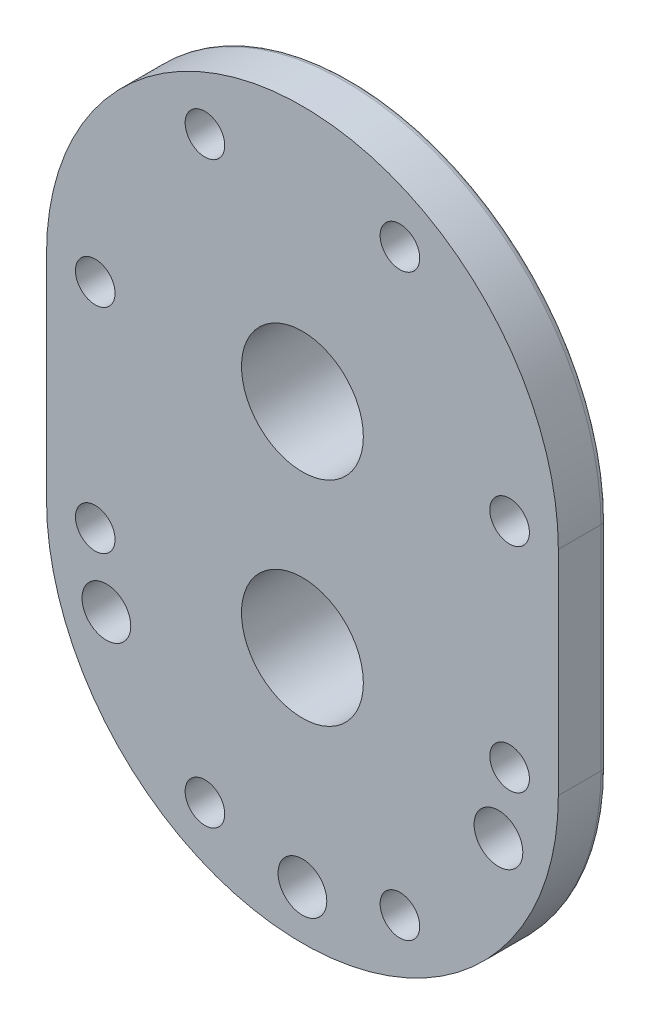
SolidWorks part; units mm, degrees
ref_plane "正面" through (0, 0, 0) normal (0, 0, 1) x (1, 0, 0)
ref_plane "平面" through (0, 0, 0) normal (0, 1, 0) x (1, 0, 0)
ref_plane "右側面" through (0, 0, 0) normal (1, 0, 0) x (0, 0, -1)
sketch "s-歯車レイアウト" plane through (0, 0, 0) normal (0, 0, 1) x (1, 0, 0)
  line L0 (0, 0) -> (0, -35) construction
  circle A0 centre (0, 0) radius 10
  circle A1 centre (0, -35) radius 10
  dimension "D1" = 20
  dimension "D2" = 35
sketch "s-カバー" plane through (0, 0, 0) normal (0, 0, 1) x (1, 0, 0)
  circle A0 centre (0, 0) radius 18
  circle A1 centre (0, -35) radius 18
  dimension "D1" = 36
sketch "s-フランジ形状" plane through (0, 0, 0) normal (0, 0, 1) x (1, 0, 0)
  circle A2 centre (0, 0) radius 42
  circle A3 centre (0, -35) radius 42
  dimension "D1" = 84
  dimension "D2" = 119
sketch "s-穴位置1" plane through (0, 0, 0) normal (0, 0, 1) x (1, 0, 0)
  circle A0 centre (0, 0) radius 34
  circle A1 centre (0, -35) radius 34
  dimension "D1" = 68
sketch "s-穴位置2" plane through (0, 0, 0) normal (0, 0, 1) x (1, 0, 0)
  line L0 (-34, 0) -> (-34, -35)
  line L1 (34, 0) -> (34, -35)
  line L2 (16, 30) -> (16, -65) construction
  line L3 (-16, -65) -> (-16, 30) construction
  circle A0 centre (0, 0) radius 34 construction
  circle A1 centre (0, -35) radius 34 construction
  arc A2 (34, 0) -> (-34, 0) centre (0, 0) ccw
  arc A3 (-34, -35) -> (34, -35) centre (0, -35) ccw
  point P4 (16, 30)
  point P5 (34, 0)
  point P10 (34, -35)
  point P11 (16, -65)
  point P12 (-16, -65)
  point P13 (-34, -35)
  point P14 (-34, 0)
  dimension "D1" = 16
  dimension "D2" = 16
sketch "s-穴位置3" plane through (0, 0, 0) normal (0, 0, 1) x (1, 0, 0)
  line L0 (0, -35) -> (0, -69) construction
  line L1 (-32.1714, -46) -> (32.1714, -46) construction
  circle A0 centre (0, -35) radius 34 construction
  dimension "D1" = 11
sketch "ｽｹｯﾁ8" plane through (0, 0, 0) normal (0, 0, 1) x (1, 0, 0)
  line L0 (-42, 0) -> (-42, -35)
  line L1 (42, 0) -> (42, -35)
  circle A0 centre (0, 0) radius 42 construction
  circle A1 centre (0, -35) radius 42 construction
  arc A2 (42, 0) -> (-42, 0) centre (0, 0) ccw
  arc A3 (-42, -35) -> (42, -35) centre (0, -35) ccw
extrude "ﾎﾞｽ - 押し出し1" add sketch "ｽｹｯﾁ8" against normal blind 8
sketch "ｽｹｯﾁ9" plane through (0, 0, 0) normal (0, 0, 1) x (1, 0, 0)
  line L0 (-18, 0) -> (-18, -35)
  line L1 (18, 0) -> (18, -35)
  circle A0 centre (0, 0) radius 18 construction
  circle A1 centre (0, -35) radius 18 construction
  arc A2 (18, 0) -> (-18, 0) centre (0, 0) ccw
  arc A3 (-18, -35) -> (18, -35) centre (0, -35) ccw
extrude "ﾎﾞｽ - 押し出し2" add sketch "ｽｹｯﾁ9" against normal blind 24.5
sketch "ｽｹｯﾁ10" plane through (0, 0, 0) normal (0, 0, 1) x (1, 0, 0)
  circle A0 centre (0, 0) radius 10 construction
  circle A1 centre (0, -35) radius 10 construction
  circle A2 centre (0, 0) radius 10
  circle A3 centre (0, -35) radius 10
extrude "ｶｯﾄ - 押し出し1" cut sketch "ｽｹｯﾁ10" against normal blind 19.5
sketch "ｽｹｯﾁ11" plane through (0, 0, 0) normal (0, 0, 1) x (1, 0, 0)
  circle A0 centre (-16, 30) radius 3.25
  dimension "D1" = 6.5
extrude "ｶｯﾄ - 押し出し2" cut sketch "ｽｹｯﾁ11" against normal through all
pattern_sketch "ｽｹｯﾁ-ﾊﾟﾀｰﾝ1" of "ｶｯﾄ - 押し出し2"
fillet "ﾌｨﾚｯﾄ1" radius 1 12 edges at (42, -17.5, -8) (0, -77, -8) (-42, -17.5, -8) (18, -17.5, -8) (0, -53, -8) (-18, -17.5, -8) (18, -17.5, -24.5) (0, -53, -24.5) (-18, -17.5, -24.5) (0, 42, -8) (0, 18, -8) (0, 18, -24.5)
sketch "ｽｹｯﾁ12" plane through (0, 0, 0) normal (0, 0, 1) x (1, 0, 0)
  circle A0 centre (-32.1714, -46) radius 4
  circle A1 centre (0, -69) radius 4
  circle A2 centre (32.1714, -46) radius 4
  dimension "D1" = 8
extrude "ｶｯﾄ - 押し出し3" cut sketch "ｽｹｯﾁ12" against normal through all
